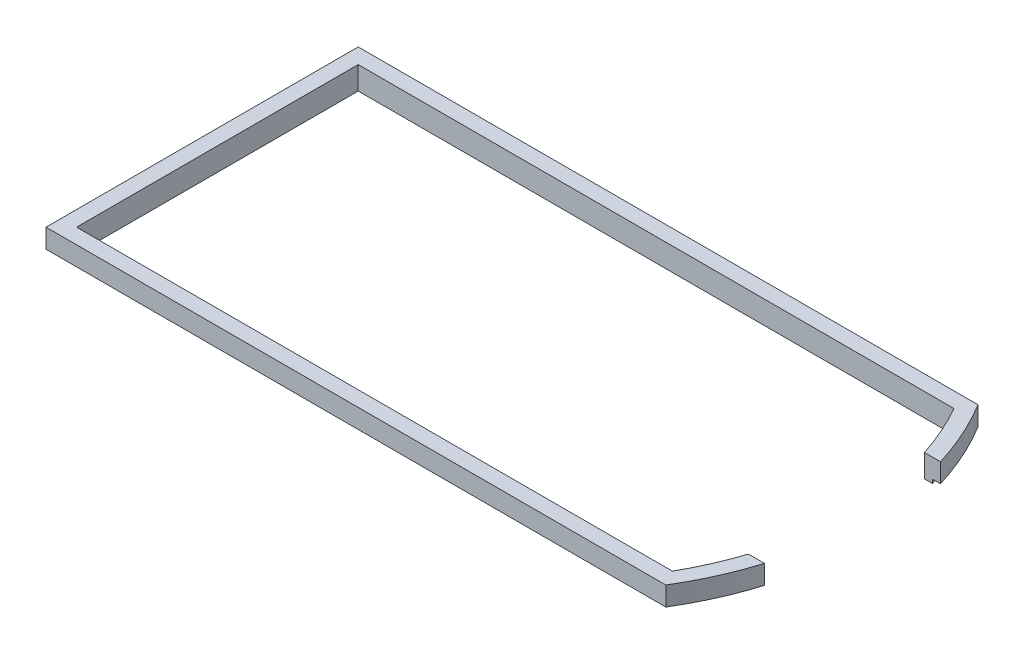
SolidWorks part; units mm, degrees
ref_plane "Plan de face" through (0, 0, 0) normal (0, 0, 1) x (1, 0, 0)
ref_plane "Plan de dessus" through (0, 0, 0) normal (0, 1, 0) x (1, 0, 0)
ref_plane "Plan de droite" through (0, 0, 0) normal (1, 0, 0) x (0, 0, -1)
sketch "Esquisse1" plane through (0, 0, 0) normal (1, 0, 0) x (0, 0, -1)
  line L0 (2.4, 0) -> (2.4, 8) construction
  line L1 (0, 0) -> (40.8, 0)
  line L3 (2.4, 8) -> (38.4, 8)
  line L5 (20.4, 0) -> (20.4, 8) construction
  arc A0 (0, 0) -> (2.4, 8) centre (14.5333, 0) cw
  arc A1 (2.4, 8) -> (0, 0) centre (14.5333, 0) ccw
  arc A2 (40.8, 0) -> (38.4, 8) centre (26.2667, 0) ccw
  dimension "D4" = 14.5333
  dimension "D1" = 36
  dimension "D2" = 40.8
  dimension "D3" = 8
  dimension "D5" = 2.4
ref_plane "Plan1" through (0, 0, -20.4) normal (0, 0, 1) x (1, 0, 0)
sketch "Esquisse7" plane through (0, 0, 0) normal (0, 1, 0) x (1, 0, 0)
  line L0 (80.9953, 0) -> (0, 0)
  line L1 (0, 0) -> (0, 40.8)
  line L2 (84.9957, 8.9) -> (82.8983, 8.9)
  line L3 (79.8523, 2) -> (2, 2)
  line L4 (2, 20.4) -> (90.347, 20.4) construction
  line L5 (2, 2) -> (2, 20.4)
  line L6 (2, 38.8) -> (2, 20.4)
  line L7 (79.8523, 38.8) -> (2, 38.8)
  line L8 (84.9957, 31.9) -> (82.8983, 31.9)
  line L9 (80.9953, 40.8) -> (0, 40.8)
  arc A0 (80.9953, 0) -> (84.9957, 8.9) centre (47.51, 20.4) ccw
  arc A1 (79.8523, 2) -> (82.8983, 8.9) centre (47.51, 20.4) ccw
  arc A3 (79.8523, 38.8) -> (82.8983, 31.9) centre (47.51, 20.4) cw
  arc A4 (80.9953, 40.8) -> (84.9957, 31.9) centre (47.51, 20.4) cw
  point P19 (0, 20.4)
  dimension "D3" = 11.5
  dimension "D4" = 39.21
  dimension "D1" = 20.4
  dimension "D2" = 80.9953
extrude "Extrusion2" add sketch "Esquisse7" against normal blind 2.5 separate body
sketch "Esquisse9" plane through (0, -2.5, 0) normal (0, -1, 0) x (1, 0, 0)
  line L0 (79.8523, -2) -> (2, -2)
  line L1 (2, -2) -> (2, -38.8)
  line L2 (2, -38.8) -> (79.8523, -38.8)
  line L3 (82.8983, -8.9) -> (83.9484, -8.9)
  line L4 (1, -39.8) -> (80.4287, -39.8)
  line L5 (82.8983, -31.9) -> (83.9484, -31.9)
  line L6 (1, -1) -> (1, -39.8)
  line L7 (80.4287, -1) -> (1, -1)
  arc A0 (79.8523, -2) -> (82.8983, -8.9) centre (47.51, -20.4) cw
  arc A1 (82.8983, -31.9) -> (79.8523, -38.8) centre (47.51, -20.4) cw
  arc A2 (83.9484, -31.9) -> (80.4287, -39.8) centre (47.51, -20.4) cw
  arc A3 (80.4287, -1) -> (83.9484, -8.9) centre (47.51, -20.4) cw
  arc A4 (83.8494, -32.2091) -> (80.4287, -39.8) centre (47.51, -20.4) cw construction
  arc A5 (80.4287, -1) -> (83.8494, -8.5909) centre (47.51, -20.4) cw construction
  dimension "D1" = 1
extrude "Extrusion3" add sketch "Esquisse9" along normal blind 0.5
